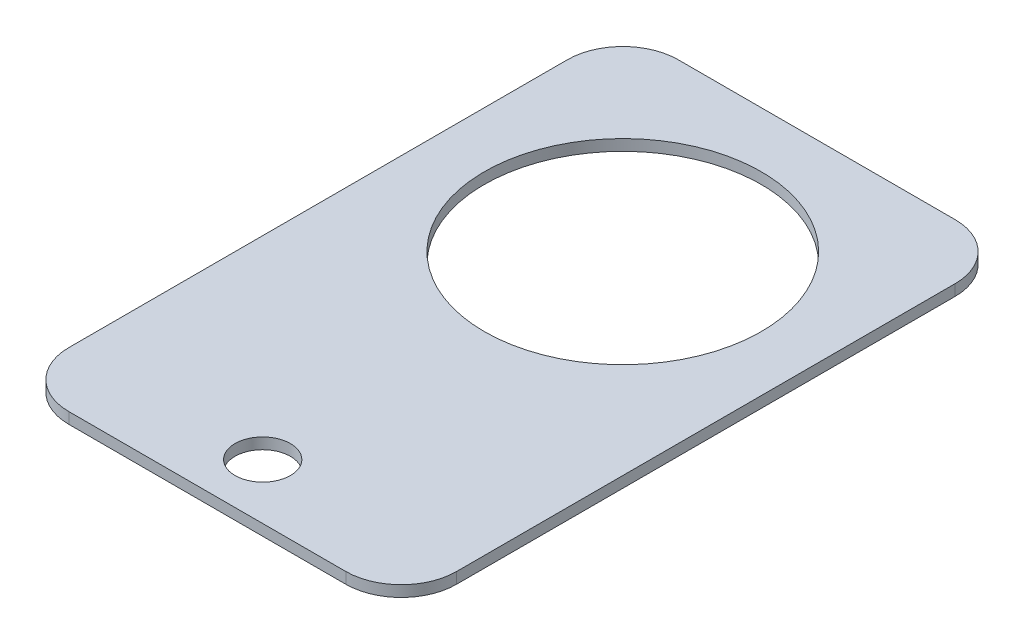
SolidWorks part; units mm, degrees
ref_plane "Plan de face" through (0, 0, 0) normal (0, 0, 1) x (1, 0, 0)
ref_plane "Plan de dessus" through (0, 0, 0) normal (0, 1, 0) x (1, 0, 0)
ref_plane "Plan de droite" through (0, 0, 0) normal (1, 0, 0) x (0, 0, -1)
sketch "Esquisse1" plane through (0, 0, 0) normal (0, 1, 0) x (1, 0, 0)
  line L1 (0, 0) -> (70, 0)
  line L2 (0, 0) -> (0, 110)
  line L3 (0, 110) -> (70, 110)
  line L4 (70, 0) -> (70, 110)
  dimension "D1" = 110
  dimension "D2" = 70
extrude "Boss.-Extru.1" add sketch "Esquisse1" along normal blind 2
sketch "Esquisse2" plane through (0, 2, 0) normal (0, 1, 0) x (1, 0, 0)
  line L0 (70, 110) -> (0, 110) construction
  line L1 (0, 0) -> (70, 0) construction
  circle A0 centre (35, 75) radius 25
  circle A1 centre (35, 10) radius 5
  point P4 (35, 110)
  point P10 (35, 0)
  dimension "D1" = 50
  dimension "D3" = 10
  dimension "D2" = 35
  dimension "D4" = 10
extrude "Enlèv. mat.-Extru.1" cut sketch "Esquisse2" against normal through all
fillet "Congé1" radius 10 4 edges at (70, 1, -110) (0, 1, -110) (0, 1, 0) (70, 1, 0)
